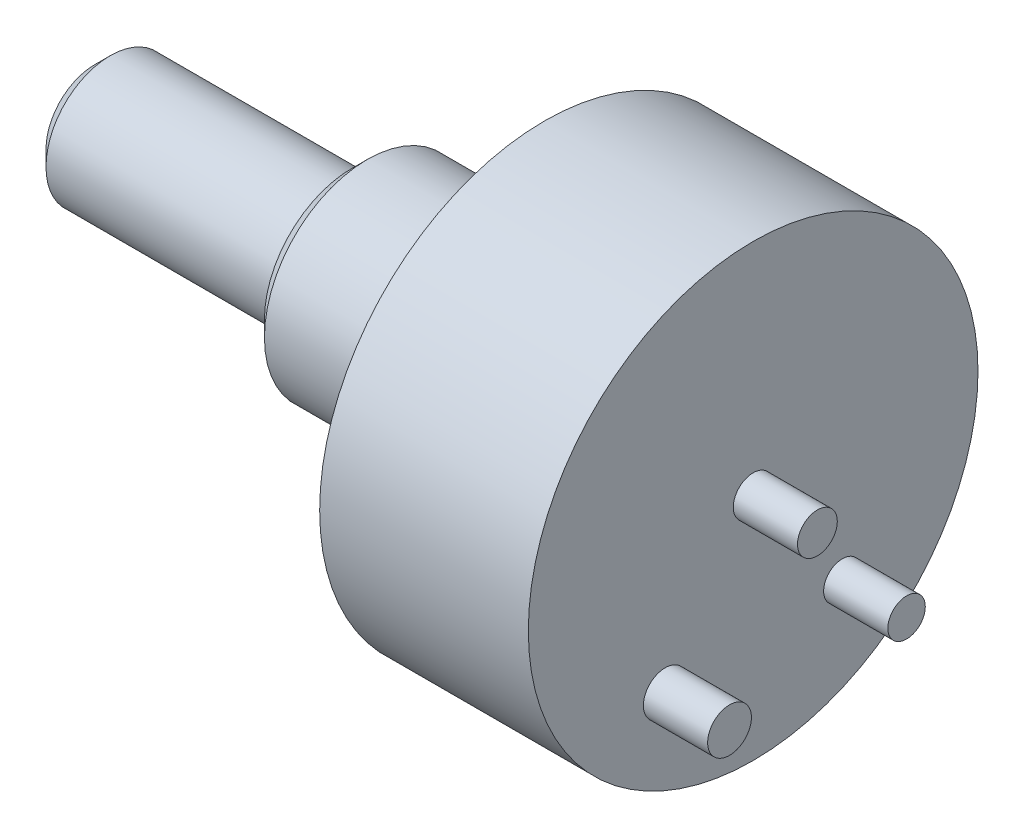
SolidWorks part; units mm, degrees
ref_plane "Front" through (0, 0, 0) normal (0, 0, 1) x (1, 0, 0)
ref_plane "Top" through (0, 0, 0) normal (0, 1, 0) x (1, 0, 0)
ref_plane "Right" through (0, 0, 0) normal (1, 0, 0) x (0, 0, -1)
sketch "Sketch1" plane through (0, 0, 0) normal (0, 0, 1) x (1, 0, 0)
  line L0 (0, 0) -> (-59.882, 0) construction
  line L1 (0, 0) -> (0, 11.1125)
  line L2 (0, 11.1125) -> (-10.3124, 11.1125)
  line L3 (-10.3124, 11.1125) -> (-10.3124, 5.207)
  line L4 (-10.3124, 5.207) -> (-11.8364, 5.207)
  line L5 (-11.8364, 5.207) -> (-11.8364, 5.08)
  line L6 (-11.8364, 5.08) -> (-19.8374, 5.08)
  line L7 (-19.8374, 5.08) -> (-19.8374, 3.175)
  line L8 (-19.8374, 3.175) -> (-32.5374, 3.175)
  line L9 (-32.5374, 3.175) -> (-32.5374, 0)
  line L10 (-32.5374, 0) -> (0, 0)
  dimension "D1" = 6.35
  dimension "D2" = 10.16
  dimension "D3" = 22.225
  dimension "D4" = 10.414
  dimension "D5" = 10.3124
  dimension "D6" = 22.225
  dimension "D7" = 9.525
  dimension "D8" = 1.524
revolve "Revolve1" add sketch "Sketch1" angle 360 about L0
chamfer "Chamfer1" distance 0.762 angle 45 2 edges at (-32.5374, 0, -3.175) (-19.8374, 0, -5.08)
sketch "Sketch2" plane through (0, 0, 0) normal (1, 0, 0) x (0, 0, -1)
  circle A0 centre (0, 0.2228) radius 0.9841
  circle A1 centre (4.4074, -5.6008) radius 0.9251
  circle A2 centre (-4.3438, -6.0463) radius 1.082
extrude "Extrude1" add sketch "Sketch2" along normal blind 3.175
